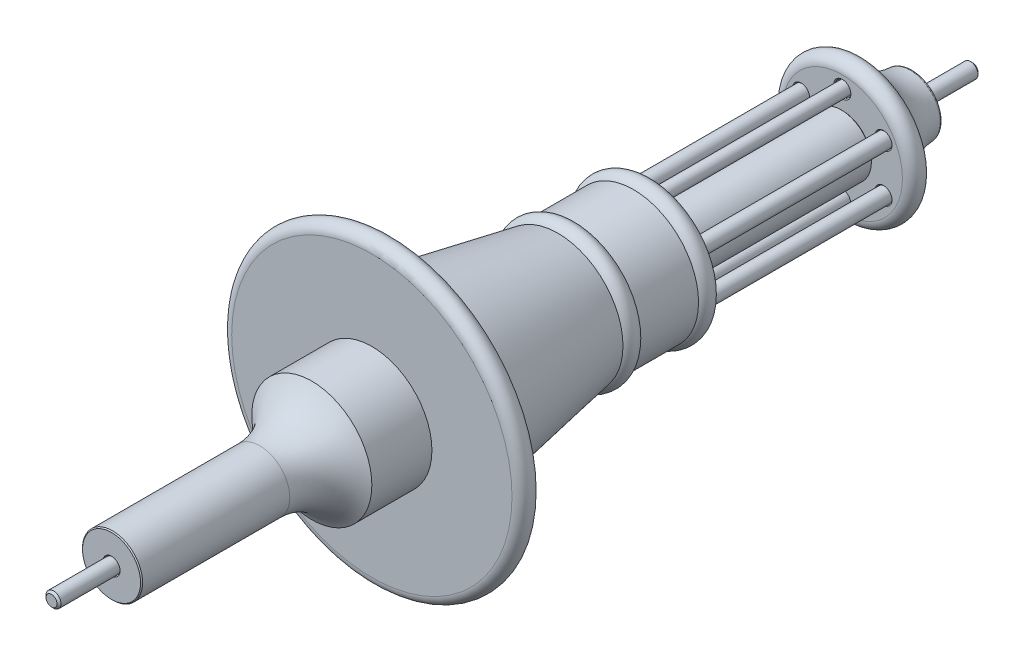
SolidWorks part; units mm, degrees
ref_plane "Спереди" through (0, 0, 0) normal (0, 0, 1) x (1, 0, 0)
ref_plane "Сверху" through (0, 0, 0) normal (0, 1, 0) x (1, 0, 0)
ref_plane "Справа" through (0, 0, 0) normal (1, 0, 0) x (0, 0, -1)
sketch "Эскиз1" plane through (0, 0, 0) normal (1, 0, 0) x (0, 0, -1)
  line L0 (0, 0) -> (90.6087, 0) construction
  line L1 (0, 0.75) -> (75, 0.75)
  line L2 (0, 0.75) -> (0, 3)
  line L3 (0, 3) -> (14.8038, 3)
  line L4 (46.3174, 6.5) -> (52.134, 6.5)
  line L5 (20, 6) -> (26, 6)
  line L6 (26, 6) -> (26, 14)
  line L7 (28.2662, 8.9477) -> (27.9986, 14.0523)
  line L8 (31.5858, 7) -> (55, 7) construction
  line L9 (54, 6) -> (54, 4)
  line L10 (55, 3) -> (73, 3)
  line L11 (73, 3) -> (73, 2.5)
  line L12 (73, 2.5) -> (75, 2.5)
  line L13 (75, 0.75) -> (75, 2.5)
  line L14 (30.2525, 9.1564) -> (44.5853, 6.5)
  line L15 (29.2648, 9) -> (45.4513, 6) construction
  arc A0 (27.9986, 14.0523) -> (26, 14) centre (27, 14) ccw
  arc A1 (14.8038, 3) -> (20, 6) centre (14.8038, 9) ccw
  arc A2 (54, 6) -> (52.134, 6.5) centre (53, 6) ccw
  arc A3 (46.3174, 6.5) -> (44.5853, 6.5) centre (45.4513, 6) ccw
  arc A4 (54, 4) -> (55, 3) centre (55, 4) ccw
  arc A5 (30.2525, 9.1564) -> (28.2662, 8.9477) centre (29.2648, 9) ccw
  dimension "D6" = 1
  dimension "D8" = 12
  dimension "D11" = 2
  dimension "D13" = 1
  dimension "D1" = 1.5
  dimension "D2" = 6
  dimension "D3" = 12
  dimension "D4" = 6
  dimension "D5" = 3
  dimension "D7" = 28
  dimension "D9" = 13
  dimension "D10" = 0.5
  dimension "D12" = 6
  dimension "D14" = 19
  dimension "D15" = 5
  dimension "D16" = 2
  dimension "D17" = 49
  dimension "D18" = 75
  dimension "D19" = 18
  dimension "D20" = 10.5
revolve "Повернуть1" add sketch "Эскиз1" angle 360 about L0
sketch "Эскиз2" plane through (0, 0, -54) normal (0, 0, -1) x (-1, 0, 0)
  line L0 (0, 4.75) -> (0, 0) construction
  line L1 (0, 0) -> (4.1136, 2.375) construction
  circle A0 centre (0, 4.75) radius 0.75
  circle A1 centre (0, 0) radius 4.75 construction
  circle A2 centre (4.1136, 2.375) radius 0.75
  circle A3 centre (4.1136, -2.375) radius 0.75
  circle A4 centre (0, -4.75) radius 0.75
  circle A5 centre (-4.1136, -2.375) radius 0.75
  circle A6 centre (-4.1136, 2.375) radius 0.75
  dimension "D1" = 1.5
  dimension "D2" = 9.5
  dimension "D4" = 60
  dimension "D3" = 6
extrude "Вырез-Вытянуть1" cut sketch "Эскиз2" against normal blind 2
sketch "Эскиз3" plane through (0, 0, 0) normal (1, 0, 0) x (0, 0, -1)
  line L0 (0, 0) -> (83.4313, 0) construction
  line L1 (80, 0.75) -> (75, 0.75)
  line L2 (75, -2.5) -> (75, 2.5) construction
  line L3 (75, 0.75) -> (75, 2.5)
  line L4 (75, 2.5) -> (73, 2.5) construction
  line L5 (75, 2.5) -> (73, 2.5)
  line L6 (73, -3) -> (73, 3) construction
  line L7 (73, 2.5) -> (73, 6)
  line L8 (80, 0.75) -> (80, 3)
  arc A0 (74.9231, 6.3846) -> (73, 6) centre (74, 6) ccw
  arc A1 (74.9231, 6.3846) -> (80, 3) centre (80, 8.5) ccw
  dimension "D4" = 2
  dimension "D6" = 11
  dimension "D1" = 6
  dimension "D2" = 1.5
  dimension "D3" = 7
  dimension "D5" = 12
revolve "Повернуть2" add sketch "Эскиз3" angle 360 about L0
sketch "Эскиз4" plane through (0, 0, -73) normal (0, 0, 1) x (1, 0, 0)
  circle A0 centre (0, 4.75) radius 0.75 construction
  circle A3 centre (4.1136, 2.375) radius 0.75 construction
  circle A4 centre (-4.1136, 2.375) radius 0.75 construction
  circle A5 centre (4.1136, -2.375) radius 0.75 construction
  circle A6 centre (0, -4.75) radius 0.75 construction
  circle A7 centre (-4.1136, -2.375) radius 0.75 construction
  circle A8 centre (0, 4.75) radius 0.75
  circle A9 centre (4.1136, 2.375) radius 0.75
  circle A10 centre (-4.1136, 2.375) radius 0.75
  circle A11 centre (4.1136, -2.375) radius 0.75
  circle A12 centre (0, -4.75) radius 0.75
  circle A13 centre (-4.1136, -2.375) radius 0.75
extrude "Вырез-Вытянуть2" cut sketch "Эскиз4" against normal blind 2
sketch "Эскиз6" plane through (0, 0, 0) normal (1, 0, 0) x (0, 0, -1)
  line L0 (-6, 0) -> (86, 0)
  line L1 (-6, 0) -> (-6, 0.75)
  line L2 (-6, 0.75) -> (86, 0.75)
  line L3 (86, 0.75) -> (86, 0)
  line L4 (80, -3) -> (80, 3) construction
  dimension "D1" = 0.75
  dimension "D2" = 6
  dimension "D3" = 6
revolve "Повернуть3" add sketch "Эскиз6" angle 360 about L0
chamfer "Фаска1" distance 0.2 angle 45 2 edges at (0.75, 0, 6) (0.75, 0, -86)
chamfer "Фаска2" distance 0.1 angle 45 15 edges at (-0.75, -4.75, -54) (-0.75, -4.75, -52) (-4.8636, -2.375, -54) (-4.8636, -2.375, -52) (-4.8636, 2.375, -54) (-4.8636, 2.375, -52) (-0.75, 4.75, -54) (-0.75, 4.75, -52) (3.3636, -2.375, -54) (3.3636, -2.375, -52) (3.3636, 2.375, -54) (3.3636, 2.375, -52) (0.75, 0, 0) (3, 0, 0) (3, 0, -73)
chamfer "Фаска3" distance 0.1 angle 45 8 edges at (2.5, 0, -73) (-3.3636, -2.375, -73) (0.75, -4.75, -73) (4.8636, -2.375, -73) (-3.3636, 2.375, -73) (4.8636, 2.375, -73) (0.75, 4.75, -73) (0.75, 0, -80)
sketch "Эскиз7" plane through (0, 0, -52) normal (0, 0, -1) x (-1, 0, 0)
  circle A0 centre (-4.1136, 2.375) radius 0.75 construction
  circle A1 centre (0, 4.75) radius 0.65
  circle A2 centre (0, 4.75) radius 0.65
  circle A3 centre (-4.1136, -2.375) radius 0.75 construction
  circle A4 centre (0, -4.75) radius 0.75 construction
  circle A5 centre (4.1136, -2.375) radius 0.75 construction
  circle A6 centre (4.1136, 2.375) radius 0.75 construction
  circle A7 centre (-4.1136, 2.375) radius 0.75
  circle A8 centre (-4.1136, -2.375) radius 0.75
  circle A9 centre (0, -4.75) radius 0.75
  circle A10 centre (4.1136, -2.375) radius 0.75
  circle A11 centre (4.1136, 2.375) radius 0.75
  dimension "D1" = 0
extrude "Бобышка-Вытянуть1" add sketch "Эскиз7" along normal up to surface (23 mm away) separate body
chamfer "Фаска4" distance 0.1 angle 45 2 edges at (-4.8636, -2.375, -52) (-3.3636, -2.375, -75)
chamfer "Фаска5" distance 0.1 angle 45 2 edges at (-4.8636, 2.375, -52) (-3.3636, 2.375, -75)
chamfer "Фаска6" distance 0.1 angle 45 2 edges at (-0.65, 4.75, -52) (0.65, 4.75, -75)
chamfer "Фаска7" distance 0.1 angle 45 2 edges at (3.3636, 2.375, -52) (4.8636, 2.375, -75)
chamfer "Фаска8" distance 0.1 angle 45 2 edges at (3.3636, -2.375, -52) (4.8636, -2.375, -75)
chamfer "Фаска9" distance 0.1 angle 45 2 edges at (-0.75, -4.75, -52) (0.75, -4.75, -75)
fillet "Скругление1" radius 0.25 1 edges at (3, 0, -80)
